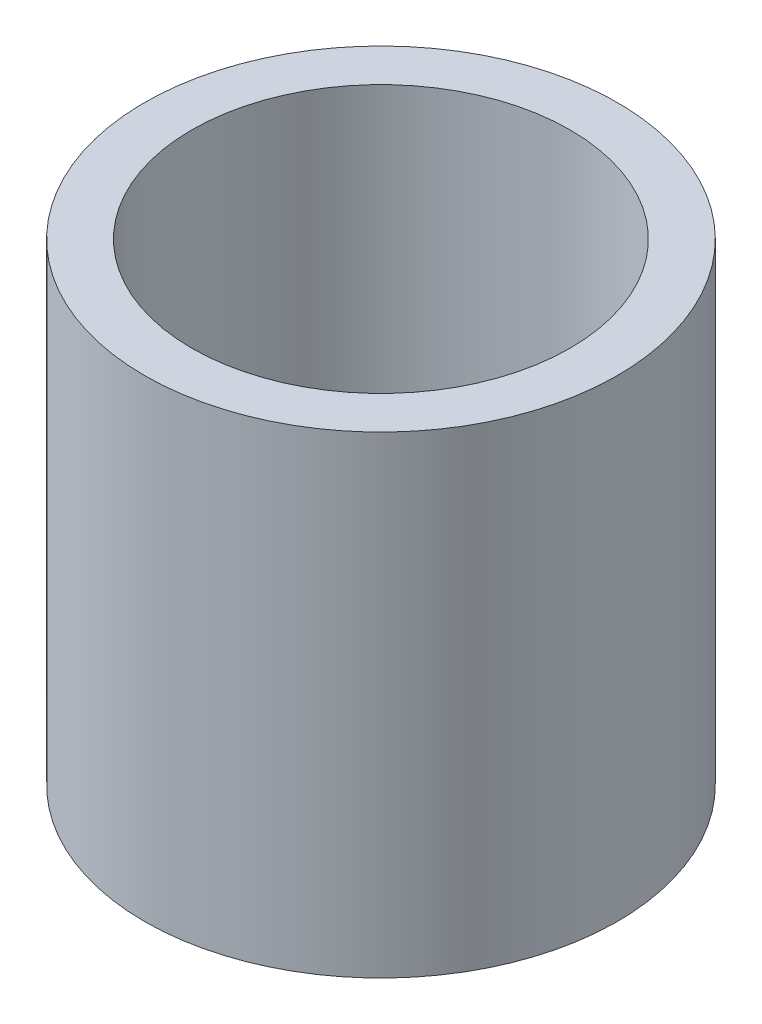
SolidWorks part; units mm, degrees
ref_plane "Front Plane" through (0, 0, 0) normal (0, 0, 1) x (1, 0, 0)
ref_plane "Top Plane" through (0, 0, 0) normal (0, 1, 0) x (1, 0, 0)
ref_plane "Right Plane" through (0, 0, 0) normal (1, 0, 0) x (0, 0, -1)
sketch "Sketch2" plane through (0, 0, 0) normal (0, 1, 0) x (1, 0, 0)
  circle A0 centre (0, 0) radius 50
  circle A1 centre (0, 0) radius 40
  dimension "D1" = 100
  dimension "D2" = 80
extrude "Boss-Extrude1" add sketch "Sketch2" along normal blind 100
ref_plane "Plane1" through (0, 20, 0) normal (0, -1, 0) x (-1, 0, 0)
